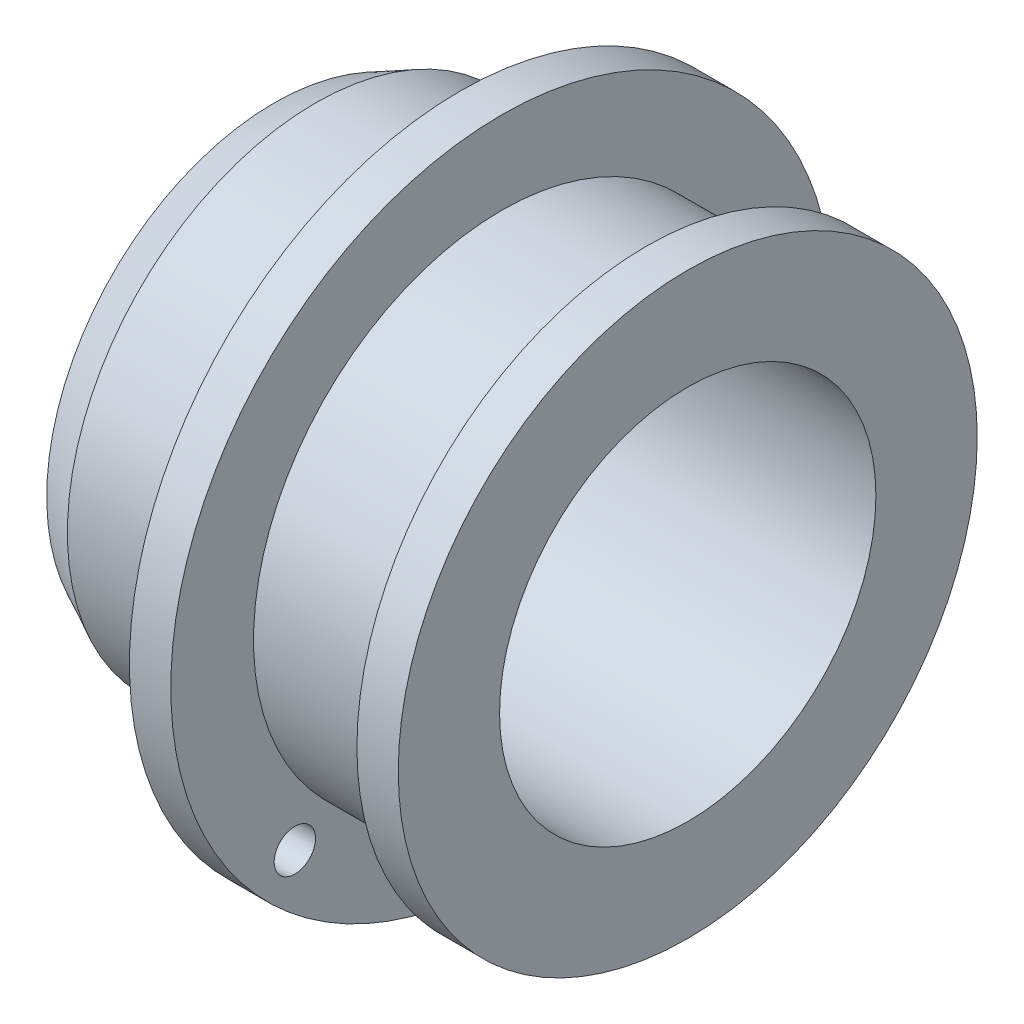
SolidWorks part; units mm, degrees
ref_plane "Front Plane" through (0, 0, 0) normal (0, 0, 1) x (1, 0, 0)
ref_plane "Top Plane" through (0, 0, 0) normal (0, 1, 0) x (1, 0, 0)
ref_plane "Right Plane" through (0, 0, 0) normal (1, 0, 0) x (0, 0, -1)
sketch "Sketch4" plane through (0, 0, 0) normal (0, 0, 1) x (1, 0, 0)
  line L0 (0, 0) -> (0, 69.85)
  line L1 (0, 69.85) -> (12.7, 76.2)
  line L2 (12.7, 76.2) -> (57.15, 76.2)
  line L3 (57.15, 76.2) -> (57.15, 101.6)
  line L4 (57.15, 101.6) -> (69.85, 101.6)
  line L5 (69.85, 101.6) -> (69.85, 76.2)
  line L6 (69.85, 76.2) -> (114.3, 76.2)
  line L7 (114.3, 76.2) -> (114.3, 88.9)
  line L8 (114.3, 88.9) -> (127, 88.9)
  line L9 (127, 88.9) -> (127, 0)
  line L10 (127, 0) -> (0, 0)
  point P7 (120.65, 88.9)
  dimension "D1" = 6.35
  dimension "D2" = 88.9
  dimension "D3" = 12.7
  dimension "D4" = 12.7
  dimension "D5" = 0
  dimension "D6" = 25.4
  dimension "D7" = 12.7
  dimension "D8" = 127
  dimension "D9" = 101.6
  dimension "D10" = 44.45
  dimension "D11" = 12.7
revolve "Revolve2" add sketch "Sketch4" angle 360 about L10
sketch "Sketch6" plane through (69.85, 0, 0) normal (1, 0, 0) x (0, 0, -1)
  circle A0 centre (-63.5, -62.217) radius 6.35
  circle A1 centre (0, 0) radius 88.9 construction
  circle A2 centre (63.5, -62.217) radius 6.35
  dimension "D1" = 12.7
  dimension "D2" = 12.7
  dimension "D3" = 127
  dimension "D4" = 63.5
  dimension "D5" = 63.5
extrude "Cut-Extrude1" cut sketch "Sketch6" against normal blind 76.2
sketch "Sketch7" plane through (0, 0, 0) normal (-1, 0, 0) x (0, 0, 1)
  circle A0 centre (0, 0) radius 57.785
  dimension "D1" = 115.57
extrude "Cut-Extrude2" cut sketch "Sketch7" against normal blind 139.7
